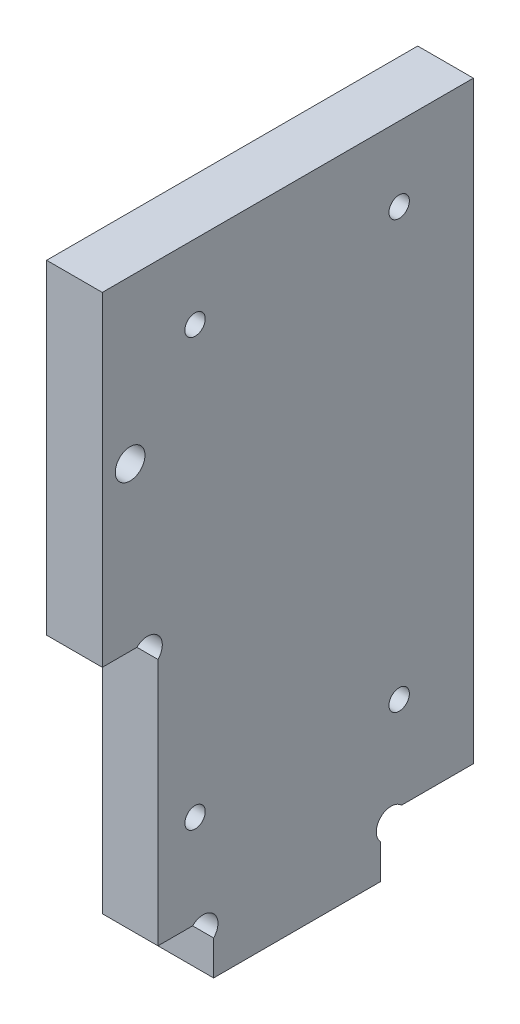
SolidWorks part; units mm, degrees
ref_plane "Plan de face" through (0, 0, 0) normal (0, 0, 1) x (1, 0, 0)
ref_plane "Plan de dessus" through (0, 0, 0) normal (0, 1, 0) x (1, 0, 0)
ref_plane "Plan de droite" through (0, 0, 0) normal (1, 0, 0) x (0, 0, -1)
sketch "Esquisse1" plane through (0, 0, 0) normal (1, 0, 0) x (0, 0, -1)
  line L0 (0, -12.3932) -> (0, 73.2692) construction
  line L1 (-33.5482, 0) -> (73.0008, 0) construction
  line L2 (9, -6.978) -> (9, 8.1252) construction
  line L3 (42.002, 6) -> (-27.9699, 6) construction
  line L4 (19, -12.3932) -> (19, 79.4765) construction
  line L5 (73.0008, 70) -> (-33.5482, 70) construction
  line L6 (-21, 79.4765) -> (-21, -12.3932) construction
  line L7 (42.002, 16) -> (-2.6743, 16) construction
  line L8 (42.002, 62) -> (-3.5552, 62) construction
  line L9 (11, 62.9903) -> (11, 10.5113) construction
  line L10 (9, 6) -> (24.6065, -9.6065) construction
  line L11 (9, 3.7373) -> (9, 0)
  line L12 (-9, 3.7373) -> (-9, 0)
  line L13 (-9, 0) -> (9, 0)
  line L14 (11.2627, 6) -> (19, 6)
  line L15 (-11.2627, 6) -> (-15, 6)
  line L16 (19, 6) -> (19, 70)
  line L17 (19, 70) -> (-21, 70)
  line L18 (-21, 70) -> (-21, 35)
  line L19 (-15, -12.3932) -> (-15, 73.2692) construction
  line L20 (-33.5482, 35) -> (-13.2398, 35) construction
  line L21 (-27.9699, 52.5) -> (-13.2398, 52.5) construction
  line L22 (-18, 60.7204) -> (-18, 48.3005) construction
  line L23 (-15, 35) -> (-28.4313, 21.5687) construction
  line L24 (-21, 35) -> (-17.2627, 35)
  line L25 (-15, 32.7373) -> (-15, 6)
  arc A0 (11.2627, 6) -> (9, 3.7373) centre (10.1314, 4.8686) ccw
  circle A1 centre (11, 16) radius 1.1
  circle A2 centre (11, 62) radius 1.1
  arc A3 (-11.2627, 6) -> (-9, 3.7373) centre (-10.1314, 4.8686) cw
  circle A4 centre (-11, 62) radius 1.1
  circle A5 centre (-11, 16) radius 1.1
  arc A6 (-15, 32.7373) -> (-17.2627, 35) centre (-16.1314, 33.8686) ccw
  circle A7 centre (-18, 52.5) radius 1.6
  dimension "D10" = 6
  dimension "D1" = 70
  dimension "D2" = 6
  dimension "D3" = 19
  dimension "D4" = 9
  dimension "D5" = 40
  dimension "D6" = 10
  dimension "D7" = 46
  dimension "D8" = 11
  dimension "D9" = 45
  dimension "D11" = 35
  dimension "D12" = 17.5
  dimension "D13" = 3
  dimension "D14" = 45
extrude "Boss.-Extru.1" add sketch "Esquisse1" along normal blind 6
